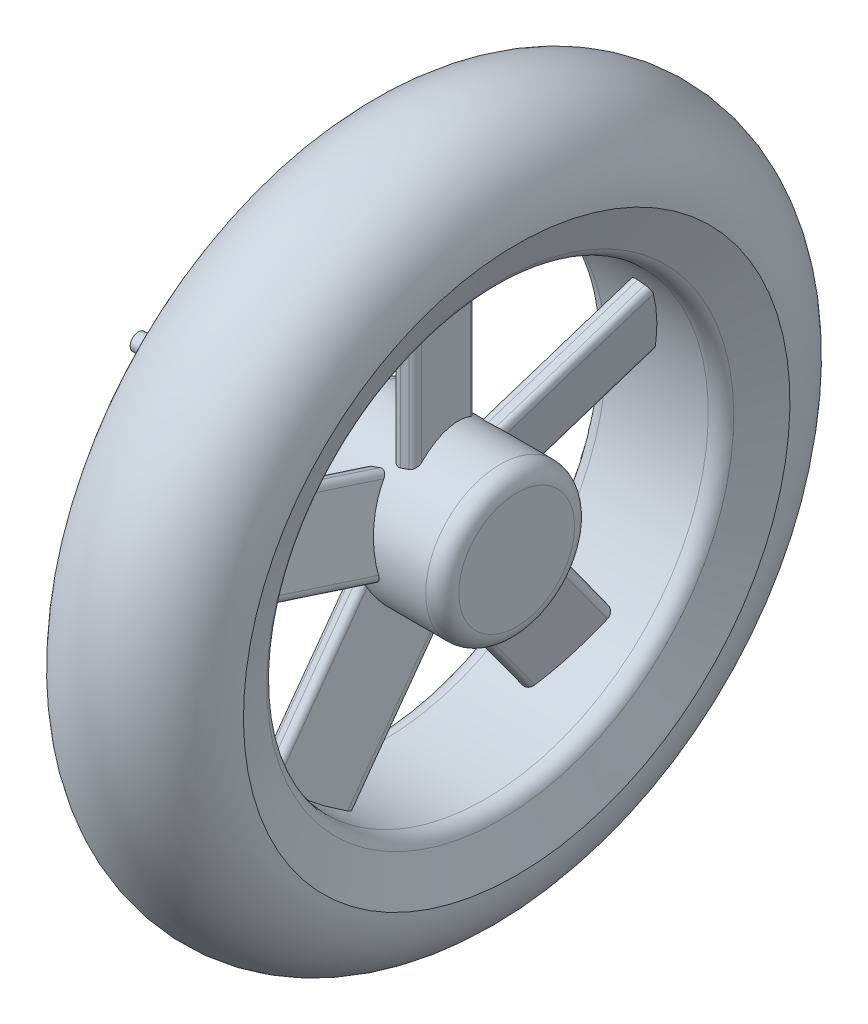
SolidWorks part; units mm, degrees
ref_plane "Plan de face" through (0, 0, 0) normal (0, 0, 1) x (1, 0, 0)
ref_plane "Plan de dessus" through (0, 0, 0) normal (0, 1, 0) x (1, 0, 0)
ref_plane "Plan de droite" through (0, 0, 0) normal (1, 0, 0) x (0, 0, -1)
sketch "Esquisse1" plane through (0, 0, 0) normal (0, 0, 1) x (1, 0, 0)
  line L0 (0, 0) -> (287.9695, 0) construction
  line L1 (8.6603, 5) -> (55.0397, 5)
  line L2 (-15, 0) -> (213.7, 0)
  line L3 (-15, 0) -> (-15, 5)
  line L4 (-15, 5) -> (-8.6603, 5)
  line L7 (113.7, 5) -> (113.7, 35)
  line L8 (123.7, 45) -> (203.7, 45)
  line L9 (213.7, 0) -> (213.7, 35)
  line L10 (72.3603, 5) -> (113.7, 5)
  arc A0 (8.6603, 5) -> (-8.6603, 5) centre (0, 0) ccw
  arc A1 (72.3603, 5) -> (55.0397, 5) centre (63.7, 0) ccw
  arc A2 (203.7, 45) -> (213.7, 35) centre (203.7, 35) cw
  arc A3 (113.7, 35) -> (123.7, 45) centre (123.7, 35) cw
  dimension "D2" = 10
  dimension "D3" = 10
  dimension "D9" = 10
  dimension "D1" = 63.7
  dimension "D4" = 10
  dimension "D5" = 15
  dimension "D6" = 50
  dimension "D7" = 100
  dimension "D8" = 90
revolve "Révolution1" add sketch "Esquisse1" angle 360 about L0
sketch "Esquisse2" plane through (0, 0, 0) normal (0, 0, 1) x (1, 0, 0)
  line L0 (0, 0) -> (576.9117, 0) construction
  line L1 (213.7, 165.1777) -> (203.757, 141.1732)
  line L2 (194.5182, 135) -> (132.8818, 135)
  line L3 (123.643, 141.1732) -> (113.7, 165.1777)
  line L4 (163.7, 213.5) -> (163.7, 45) construction
  line L6 (213.7, -45) -> (213.7, 45) construction
  line L7 (203.7, 45) -> (123.7, 45) construction
  arc A0 (213.7, 165.1777) -> (113.7, 165.1777) centre (163.7, 163.4709) ccw
  arc A1 (123.643, 141.1732) -> (132.8818, 135) centre (132.8818, 145) ccw
  arc A2 (203.757, 141.1732) -> (194.5182, 135) centre (194.5182, 145) cw
  point P16 (126.2, 135)
  point P19 (201.2, 135)
  dimension "D5" = 10
  dimension "D1" = 427
  dimension "D2" = 270
  dimension "D3" = 45
  dimension "D4" = 75
revolve "Révolution2" add sketch "Esquisse2" angle 360 about L0
sketch "Esquisse3" plane through (0, 0, 0) normal (0, 1, 0) x (1, 0, 0)
  line L0 (0, 0) -> (299.4701, 0) construction
  line L1 (152.4692, 18.7315) -> (163.3396, -21.8374)
  line L2 (168.2386, -24.6658) -> (172.1023, -23.6305)
  line L3 (174.9308, -18.7315) -> (164.0604, 21.8374)
  line L4 (159.1614, 24.6658) -> (155.2977, 23.6305)
  line L5 (157.9044, -1.5529) -> (169.4956, 1.5529) construction
  line L6 (163.7, 0) -> (163.7, 136.4274) construction
  line L7 (113.7, -165.1777) -> (113.7, 165.1777) construction
  arc A0 (159.1614, 24.6658) -> (164.0604, 21.8374) centre (160.1967, 20.8021) cw
  arc A1 (152.4692, 18.7315) -> (155.2977, 23.6305) centre (156.3329, 19.7668) cw
  arc A2 (163.3396, -21.8374) -> (168.2386, -24.6658) centre (167.2033, -20.8021) ccw
  arc A3 (172.1023, -23.6305) -> (174.9308, -18.7315) centre (171.0671, -19.7668) ccw
  dimension "D3" = 4
  dimension "D4" = 4
  dimension "D1" = 12
  dimension "D2" = 50
  dimension "D5" = 75
  dimension "D6" = 50
extrude "Extrusion1" add sketch "Esquisse3" along normal up to surface (132.7275 mm away)
pattern_circular "Répétition circulaire1" count 5 every 72 about axis through (0, 0, 0) along (1, 0, 0) of "Extrusion1"
sketch "Esquisse4" plane through (0, 0, 0) normal (0, 0, 1) x (1, 0, 0)
  line L0 (0, 0) -> (287.9695, 0) construction
  line L1 (18.5, 36.8) -> (36.5, 36.8)
  line L2 (18.5, 36.8) -> (18.5, 0)
  line L3 (18.5, 0) -> (36.5, 0)
  line L4 (36.5, 36.8) -> (36.5, 0)
  line L5 (0, 0) -> (86.2038, 0) construction
  dimension "D1" = 18.5
  dimension "D2" = 18
  dimension "D3" = 73.6
revolve "Cylindre Primitif" add sketch "Esquisse4" angle 360 about L5
